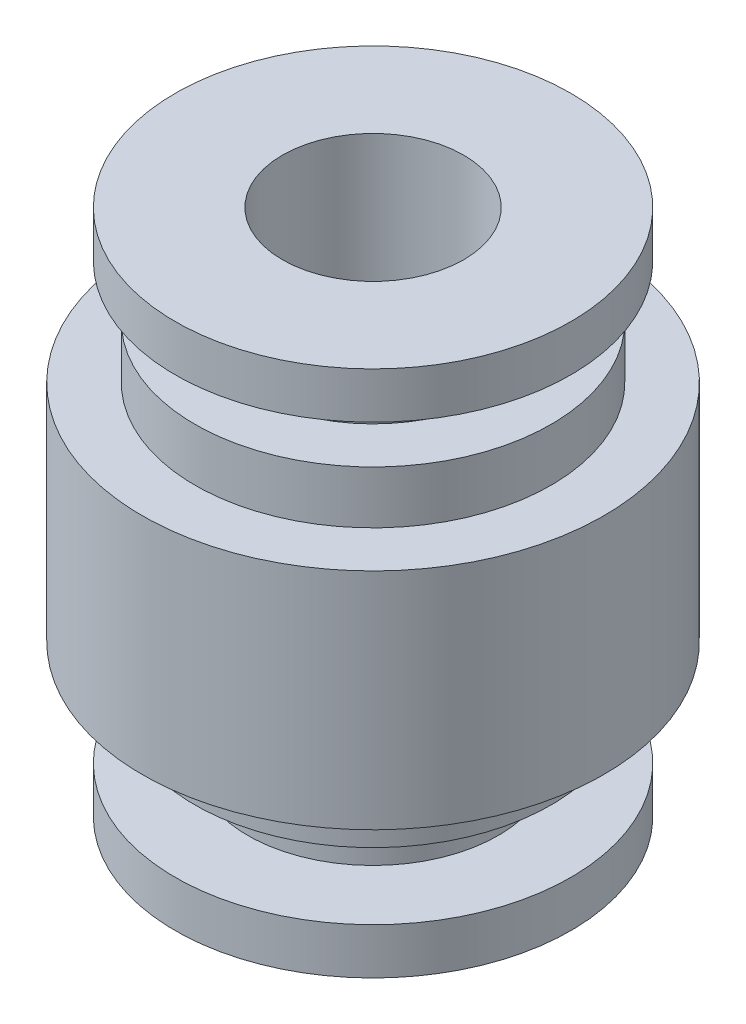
SolidWorks part; units mm, degrees
ref_plane "Front Plane" through (0, 0, 0) normal (0, 0, 1) x (1, 0, 0)
ref_plane "Top Plane" through (0, 0, 0) normal (0, 1, 0) x (1, 0, 0)
ref_plane "Right Plane" through (0, 0, 0) normal (1, 0, 0) x (0, 0, -1)
sketch "Sketch2" plane through (0, 0, 0) normal (0, 0, 1) x (1, 0, 0)
  line L0 (0, 0) -> (0, 20.32) construction
  line L1 (0, 0) -> (3.4925, 0) construction
  line L2 (3.4925, 0) -> (3.4925, 20.32)
  line L3 (0, 20.32) -> (3.4925, 20.32) construction
  line L4 (3.4925, 0) -> (7.62, 0)
  line L5 (7.62, 0) -> (7.62, 1.778)
  line L6 (7.62, 1.778) -> (4.826, 1.778)
  line L7 (4.826, 1.778) -> (4.826, 3.81)
  line L8 (4.826, 3.81) -> (6.858, 3.81)
  line L9 (6.858, 3.81) -> (6.858, 5.842)
  line L10 (6.858, 5.842) -> (8.89, 5.842)
  line L11 (8.89, 5.842) -> (8.89, 14.478)
  line L21 (6.858, 14.478) -> (8.89, 14.478)
  line L22 (6.858, 16.51) -> (6.858, 14.478)
  line L23 (0, 10.16) -> (3.4925, 10.16) construction
  line L24 (3.4925, 10.16) -> (8.89, 10.16) construction
  line L25 (4.826, 16.51) -> (6.858, 16.51)
  line L26 (4.826, 18.542) -> (4.826, 16.51)
  line L27 (7.62, 18.542) -> (4.826, 18.542)
  line L28 (7.62, 20.32) -> (7.62, 18.542)
  line L29 (3.4925, 20.32) -> (7.62, 20.32)
  dimension "D1" = 20.32
  dimension "D2" = 3.4925
  dimension "D3" = 2.032
  dimension "D4" = 1.778
  dimension "D5" = 8.89
  dimension "D6" = 7.62
  dimension "D7" = 4.826
revolve "Revolve1" add sketch "Sketch2" angle 360 about L0
